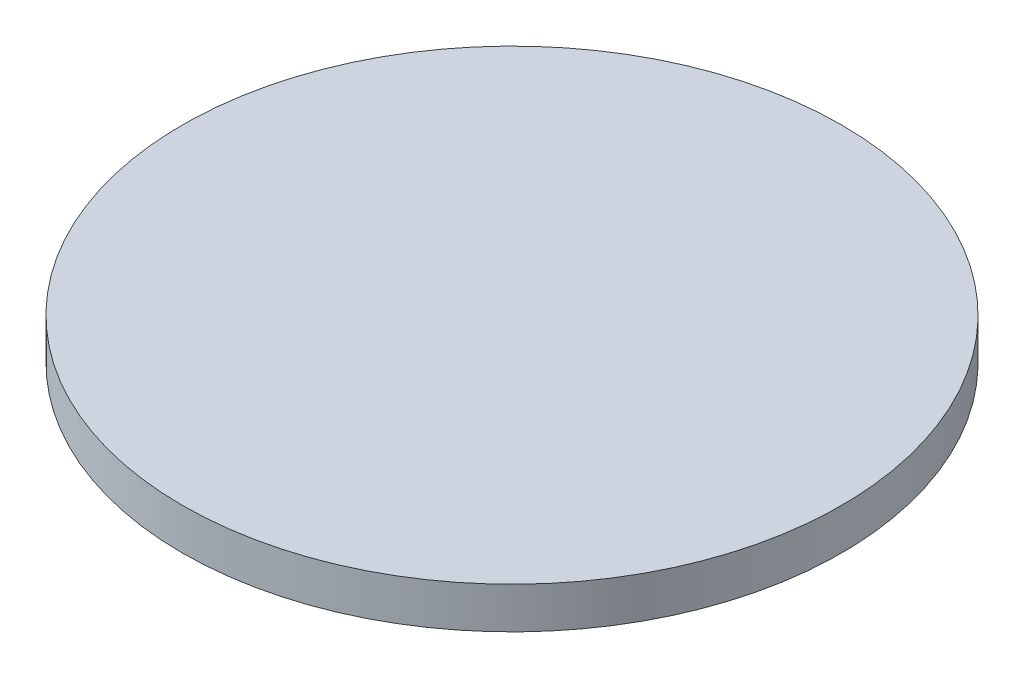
SolidWorks part; units mm, degrees
ref_plane "Front" through (0, 0, 0) normal (0, 0, 1) x (1, 0, 0)
ref_plane "Top" through (0, 0, 0) normal (0, 1, 0) x (1, 0, 0)
ref_plane "Right" through (0, 0, 0) normal (1, 0, 0) x (0, 0, -1)
sketch "Sketch1" plane through (0, 0, 0) normal (0, 1, 0) x (1, 0, 0)
  circle A0 centre (0, 0) radius 12.6746
  dimension "D1" = 25.3492
extrude "Extrude1" add sketch "Sketch1" along normal blind 1.5875
